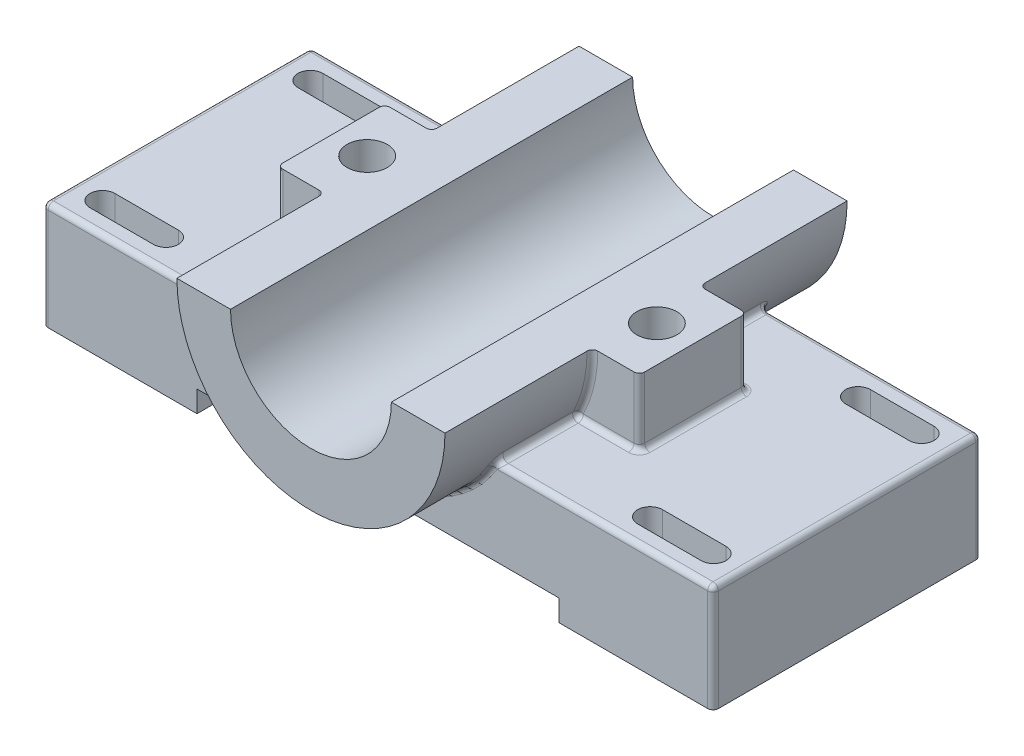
SolidWorks part; units mm, degrees
ref_plane "Front Plane" through (0, 0, 0) normal (0, 0, 1) x (1, 0, 0)
ref_plane "Top Plane" through (0, 0, 0) normal (0, 1, 0) x (1, 0, 0)
ref_plane "Right Plane" through (0, 0, 0) normal (1, 0, 0) x (0, 0, -1)
other "Configuration Table"
imported_body "Imported1"
mirror "Mirror1"
